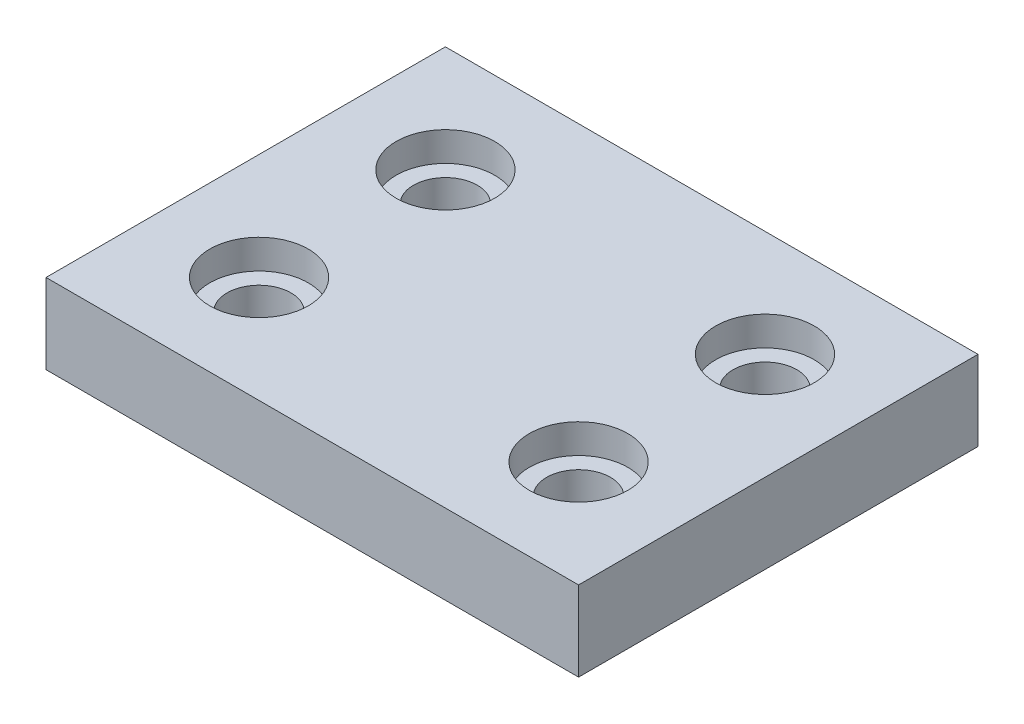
SolidWorks part; units mm, degrees
ref_plane "Front Plane" through (0, 0, 0) normal (0, 0, 1) x (1, 0, 0)
ref_plane "Top Plane" through (0, 0, 0) normal (0, 1, 0) x (1, 0, 0)
ref_plane "Right Plane" through (0, 0, 0) normal (1, 0, 0) x (0, 0, -1)
sketch "Sketch1" plane through (0, 0, 0) normal (0, 1, 0) x (1, 0, 0)
  line L1 (-50, -37.5) -> (50, -37.5)
  line L2 (-50, -37.5) -> (-50, 37.5)
  line L3 (-50, 37.5) -> (50, 37.5)
  line L4 (50, -37.5) -> (50, 37.5)
  line L5 (-50, -37.5) -> (50, 37.5) construction
  line L6 (-50, 37.5) -> (50, -37.5) construction
  point P0 (0, 0)
  dimension "D1" = 100
  dimension "D2" = 75
extrude "Boss-Extrude1" add sketch "Sketch1" along normal blind 15
hole_wizard "CBORE for M10 SBHCS1" positions "Sketch2" profile "Sketch3" counterbore size "M10" standard "ANSI Metric"
sketch "Sketch2" plane through (0, 15, 0) normal (0, 1, 0) x (-1, 0, 0)
  line L0 (50, 37.5) -> (-50, 37.5) construction
  line L1 (-50, -37.5) -> (50, -37.5) construction
  line L2 (-50, 37.5) -> (-50, -37.5) construction
  line L3 (50, -37.5) -> (50, 37.5) construction
  point P0 (30, 17.5)
  point P2 (30, -17.5)
  point P4 (-30, -17.5)
  point P6 (-30, 17.5)
  dimension "D1" = 20
  dimension "D2" = 20
  dimension "D3" = 20
  dimension "D4" = 20
  dimension "D5" = 20
sketch "Sketch3" plane through (-30, 15, 17.5) normal (1, 0, 0) x (0, 0, 1)
  line L0 (0, 0) -> (0, 15)
  line L1 (0, 15) -> (6, 15)
  line L3 (6, 15) -> (6, 5.5)
  line L4 (6, 5.5) -> (9.25, 5.5)
  line L5 (9.25, 5.5) -> (9.25, 0)
  line L7 (9.25, 0) -> (0, 0)
  line L11 (0, -6.35) -> (0, 107.95) construction
  dimension "Thru Hole Dia." = 12
  dimension "Thru Hole Depth" = 15
  dimension "C'Bore Dia." = 18.5
  dimension "C'Bore Depth" = 5.5
